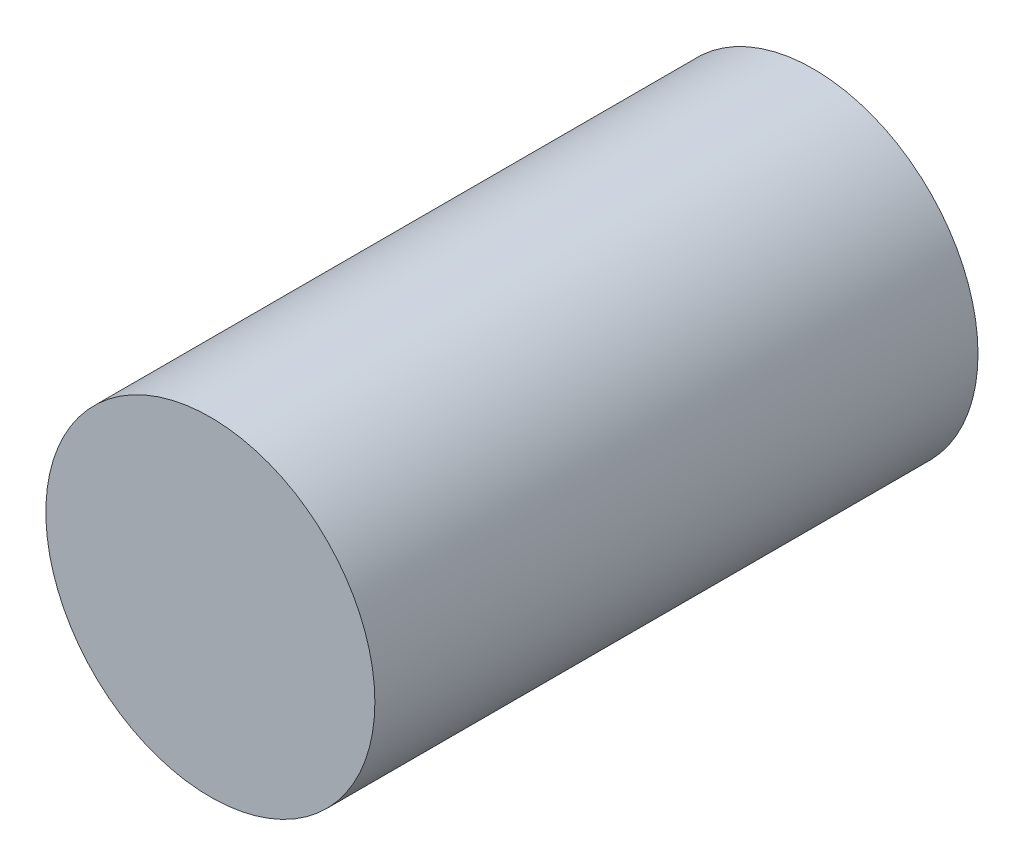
SolidWorks part; units mm, degrees
ref_plane "Front Plane" through (0, 0, 0) normal (0, 0, 1) x (1, 0, 0)
ref_plane "Top Plane" through (0, 0, 0) normal (0, 1, 0) x (1, 0, 0)
ref_plane "Right Plane" through (0, 0, 0) normal (1, 0, 0) x (0, 0, -1)
sketch "Sketch1" plane through (0, 0, 0) normal (0, 0, 1) x (1, 0, 0)
  circle A0 centre (0, 0) radius 36.3728
  dimension "D1" = 72.7456
extrude "Boss-Extrude1" add sketch "Sketch1" along normal blind 133.35
